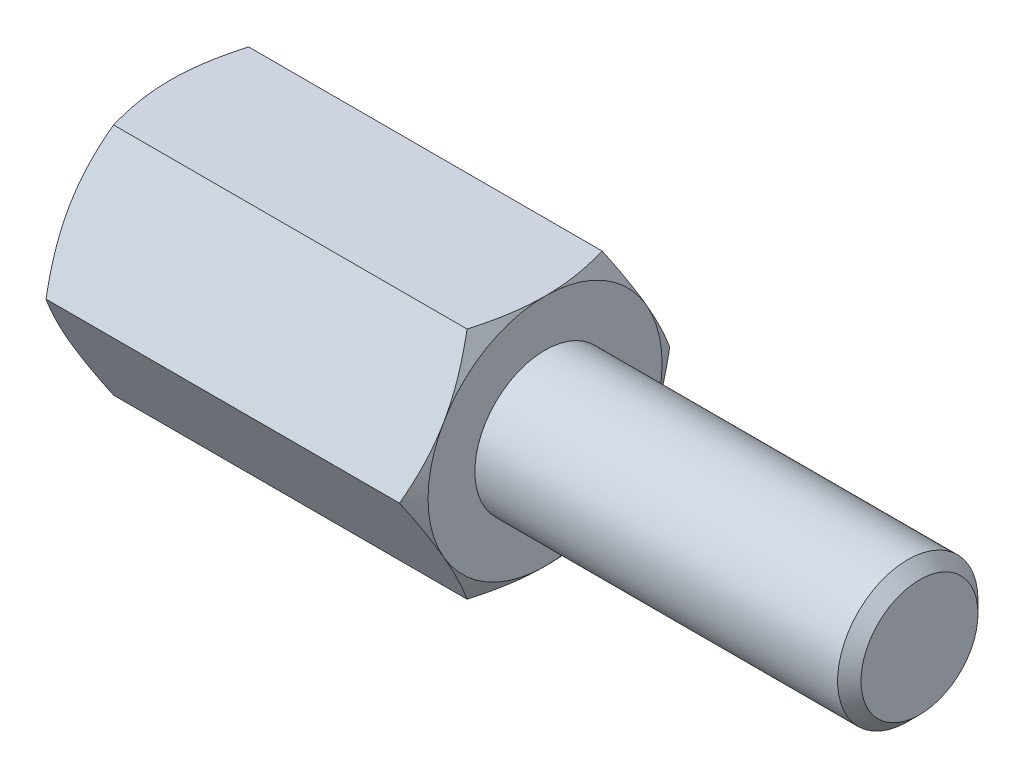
SolidWorks part; units mm, degrees
ref_plane "Front Plane" through (0, 0, 0) normal (0, 0, 1) x (1, 0, 0)
ref_plane "Top Plane" through (0, 0, 0) normal (0, 1, 0) x (1, 0, 0)
ref_plane "Right Plane" through (0, 0, 0) normal (1, 0, 0) x (0, 0, -1)
sketch "Sketch1" plane through (0, 0, 0) normal (1, 0, 0) x (0, 0, -1)
  line L1 (1.4434, 2.5) -> (-1.4434, 2.5)
  line L2 (-1.4434, 2.5) -> (-2.8868, 0)
  line L3 (-2.8868, 0) -> (-1.4434, -2.5)
  line L4 (-1.4434, -2.5) -> (1.4434, -2.5)
  line L5 (1.4434, -2.5) -> (2.8868, 0)
  line L6 (2.8868, 0) -> (1.4434, 2.5)
  circle A0 centre (0, 0) radius 2.5 construction
  dimension "D1" = 5
extrude "Extrude2" add sketch "Sketch1" along normal mid plane 8
sketch "Sketch2" plane through (0, 0, 0) normal (0, 0, 1) x (1, 0, 0)
  line L0 (-4, 2.5) -> (-2.5, 5.0981)
  line L1 (-4, 5.5) -> (-4, 2.5)
  line L3 (0, 0) -> (50000, 0) construction
  arc A0 (-2.5, 5.0981) -> (-4, 5.5) centre (-3.1962, 5.5) ccw
  dimension "D1" = 30
  dimension "D2" = 3
revolve "Cut-Revolve1" cut sketch "Sketch2" angle 360 about L3
mirror "Mirror1" about plane through (0, 0, 0) normal (1, 0, 0) of "Cut-Revolve1"
sketch "Sketch3" plane through (-4, 0, 0) normal (-1, 0, 0) x (0, 0, 1)
  circle A0 centre (0, 0) radius 1.25
  dimension "D1" = 2.5
extrude "Extrude3" cut sketch "Sketch3" against normal blind 5
sketch "Sketch4" plane through (0, 0, 0) normal (0, 0, 1) x (1, 0, 0)
  line L0 (1, 0) -> (1, 1.25)
  line L1 (3.7767, 0) -> (-3.7767, 0) construction
  line L2 (1, 1.25) -> (1.7217, 0)
  line L3 (1.7217, 0) -> (1, 0)
  line L4 (-4, 1.25) -> (-4, -1.25) construction
  point P4 (-4, 0)
  dimension "D1" = 30
  dimension "D2" = 1.25
  dimension "D3" = 5
revolve "Cut-Revolve2" cut sketch "Sketch4" angle 360 about L3
sketch "Sketch5" plane through (4, 0, 0) normal (1, 0, 0) x (0, 0, -1)
  circle A0 centre (0, 0) radius 1.5
  dimension "D1" = 3
extrude "Extrude4" add sketch "Sketch5" along normal blind 8
chamfer "Chamfer1" distance 0.25 angle 45 1 edges at (12, 0, -1.5)
equation "\"D2@Sketch4\" = \"D1@Sketch3\"/2"
